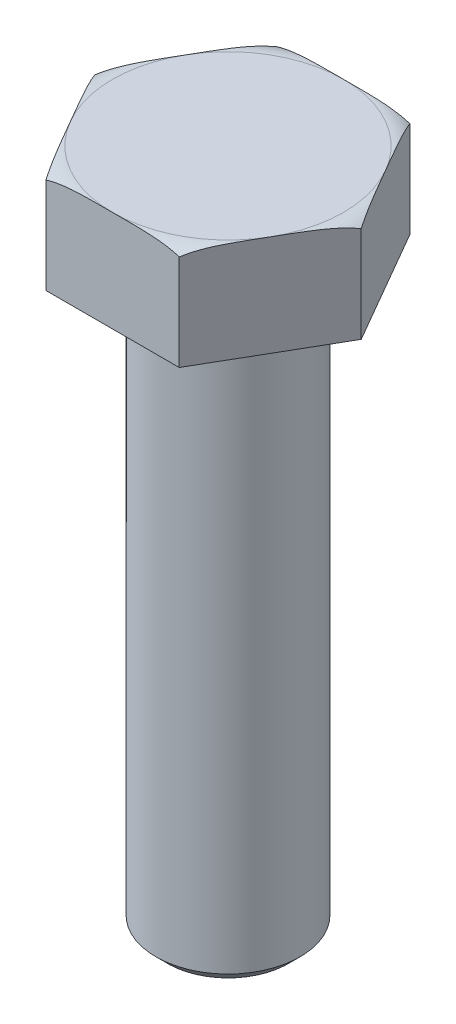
SolidWorks part; units mm, degrees
ref_plane "Plan1" through (0, 0, 0) normal (0, 0, 1) x (1, 0, 0)
ref_plane "Plan2" through (0, 0, 0) normal (0, 1, 0) x (1, 0, 0)
ref_plane "Plan3" through (0, 0, 0) normal (1, 0, 0) x (0, 0, -1)
sketch "Esquisse4" plane through (0, 0, 0) normal (0, 1, 0) x (1, 0, 0)
  line L1 (4.6188, 0) -> (2.3094, 4)
  line L2 (2.3094, 4) -> (-2.3094, 4)
  line L3 (-2.3094, 4) -> (-4.6188, 0)
  line L4 (-4.6188, 0) -> (-2.3094, -4)
  line L5 (-2.3094, -4) -> (2.3094, -4)
  line L6 (2.3094, -4) -> (4.6188, 0)
  circle A0 centre (0, 0) radius 4 construction
  dimension "S" = 8
extrude "Extrusion1" add sketch "Esquisse4" along normal blind 3.5
sketch "Esquisse1" plane through (0, 0, 0) normal (0, 0, 1) x (1, 0, 0)
  line L0 (0, 0) -> (0, -20) construction
  line L3 (0, 0) -> (2.75, 0)
  line L4 (2.5, -0.25) -> (2.5, -19.6)
  line L5 (2.1, -20) -> (0, -20)
  line L6 (2.5, -19.6) -> (2.1, -20)
  line L7 (0, -20) -> (0, 0)
  arc A1 (2.75, 0) -> (2.5, -0.25) centre (2.75, -0.25) ccw
  point P12 (2.5, -20)
revolve "Révolution1" add sketch "Esquisse1" angle 360 about L0
sketch "Esquisse2" plane through (0, 6, 0) normal (0, 0, -1) x (1, 0, 0)
  line L0 (4, 2.5) -> (4.6188, 2.5)
  line L1 (2.3094, 2.5) -> (4.6188, 2.5) construction
  line L2 (4.6188, 2.5) -> (4.6188, 6) construction
  line L3 (4.6188, 2.5) -> (4.6188, 2.6776)
  line L9 (4, 2.5) -> (4, 6) construction
  line L12 (0, 6) -> (0, 2.5) construction
  arc A0 (4, 2.5) -> (4.6188, 2.6776) centre (4, 3.6667) ccw
revolve "Enlèvement de matière-Révolution1" cut sketch "Esquisse2" angle 360 about L12
equation "\"C2@Esquisse1\"=\"D@Esquisse1\"/20"
equation "\"R@Esquisse1\"=(\"D@Esquisse1\"-\"D2@Représentation de filetage1\")/2"
equation "\"D1@Esquisse2\"=\"H@Extrusion1\"/3"
